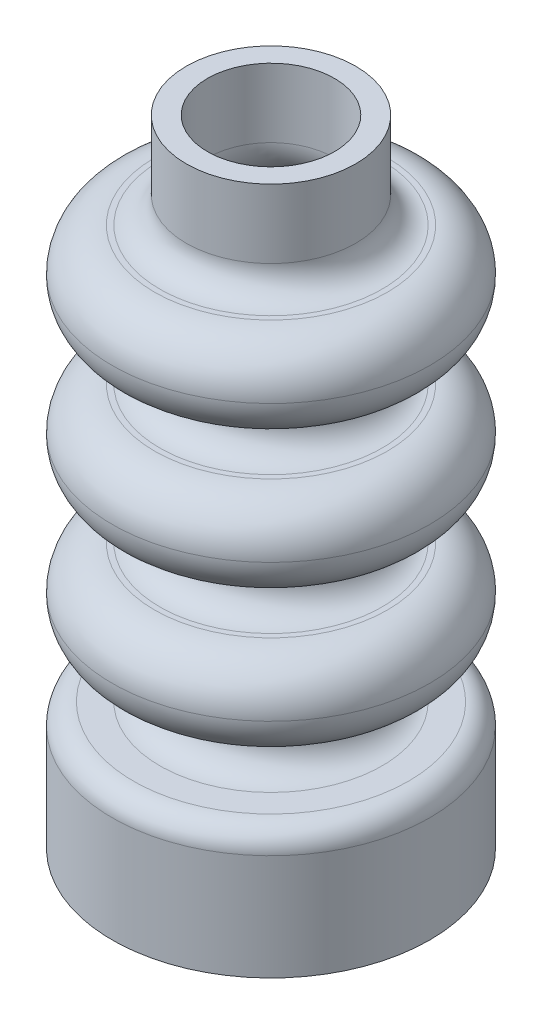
SolidWorks part; units mm, degrees
ref_plane "正面" through (0, 0, 0) normal (0, 0, 1) x (1, 0, 0)
ref_plane "平面" through (0, 0, 0) normal (0, 1, 0) x (1, 0, 0)
ref_plane "右側面" through (0, 0, 0) normal (1, 0, 0) x (0, 0, -1)
sketch "ｽｹｯﾁ1" plane through (0, 0, 0) normal (0, 0, 1) x (1, 0, 0)
  line L0 (0, 0) -> (-3.75, 0)
  line L1 (-3.75, 0) -> (-3.75, 3)
  line L2 (-3.75, 3) -> (-2, 3)
  line L3 (-2, 3) -> (-2, 4.25)
  line L4 (-2, 4.25) -> (-3.75, 4.25)
  line L5 (-3.75, 4.25) -> (-3.75, 6.25)
  line L6 (-3.75, 6.25) -> (-2, 6.25)
  line L7 (-2, 6.25) -> (-2, 7.5)
  line L8 (-2, 7.5) -> (-3.75, 7.5)
  line L9 (-3.75, 7.5) -> (-3.75, 9.5)
  line L10 (-3.75, 9.5) -> (-2, 9.5)
  line L11 (-2, 9.5) -> (-2, 10.75)
  line L13 (0, 15) -> (0, 0)
  line L14 (-2, 10.75) -> (-3.75, 10.75)
  line L15 (-3.75, 10.75) -> (-3.75, 12.75)
  line L16 (-3.75, 12.75) -> (-2, 12.75)
  line L17 (-2, 12.75) -> (-2, 15)
  line L18 (-2, 15) -> (0, 15)
  point P20 (0, 23.6138)
  dimension "D1" = 3
  dimension "D2" = 15
  dimension "D3" = 1.25
  dimension "D4" = 2
  dimension "D5" = 1.25
  dimension "D6" = 2
  dimension "D7" = 1.25
  dimension "D8" = 2
  dimension "D9" = 3.75
  dimension "D10" = 2
  dimension "D11" = 2
revolve "回転1" add sketch "ｽｹｯﾁ1" angle 360 about L13
fillet "ﾌｨﾚｯﾄ1" radius 0.625 7 edges at (-2, 4.25, 0) (-2, 3, 0) (-2, 7.5, 0) (-2, 6.25, 0) (-2, 10.75, 0) (-2, 9.5, 0) (-2, 12.75, 0)
fillet "ﾌｨﾚｯﾄ2" radius 1 5 edges at (-3.75, 9.5, 0) (-3.75, 7.5, 0) (-3.75, 12.75, 0) (-3.75, 10.75, 0) (-3.75, 6.25, 0)
fillet "ﾌｨﾚｯﾄ3" radius 1 1 edges at (-3.75, 4.25, 0)
fillet "ﾌｨﾚｯﾄ4" radius 0.5 1 edges at (-3.75, 3, 0)
shell "ｼｪﾙ1" thickness 0.5
